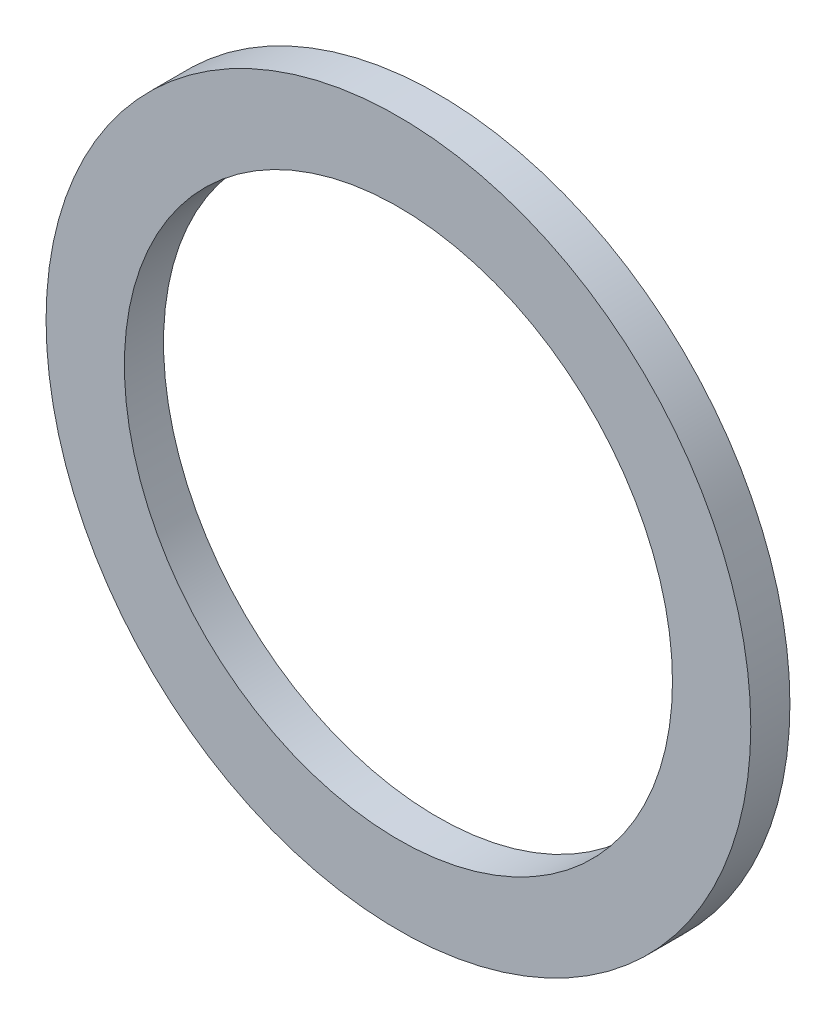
SolidWorks part; units mm, degrees
ref_plane "前视" through (0, 0, 0) normal (0, 0, 1) x (1, 0, 0)
ref_plane "上视" through (0, 0, 0) normal (0, 1, 0) x (1, 0, 0)
ref_plane "右视" through (0, 0, 0) normal (1, 0, 0) x (0, 0, -1)
sketch "草图1" plane through (0, 0, 0) normal (0, 0, 1) x (1, 0, 0)
  circle A0 centre (0, 0) radius 14
  circle A1 centre (0, 0) radius 18
  dimension "D1" = 28
  dimension "D2" = 36
extrude "拉伸1" add sketch "草图1" along normal blind 2
